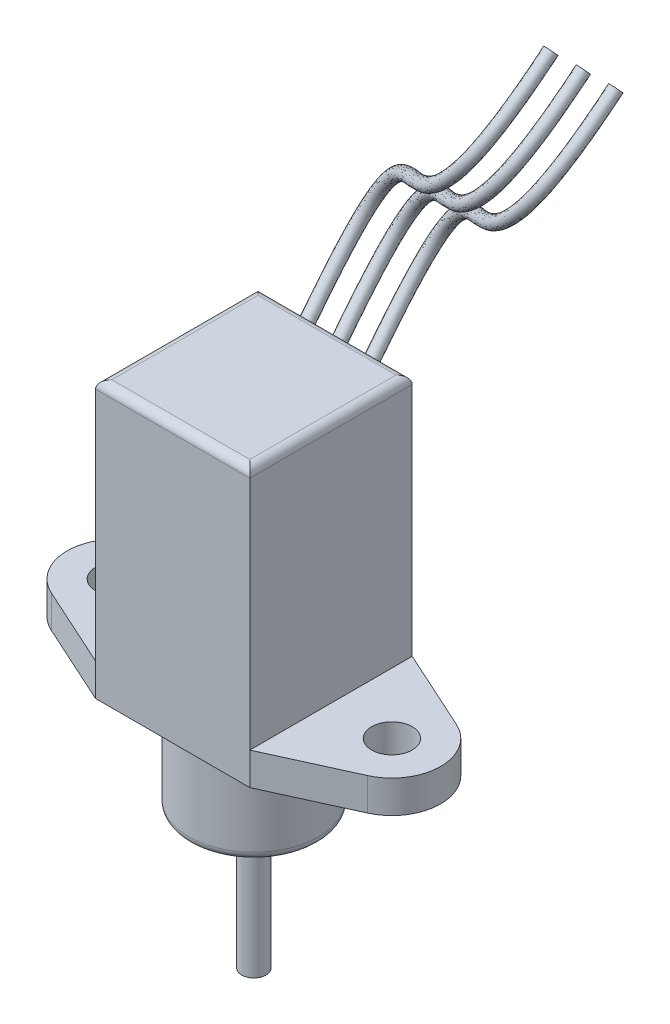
SolidWorks part; units mm, degrees
ref_plane "Plan de face" through (0, 0, 0) normal (0, 0, 1) x (1, 0, 0)
ref_plane "Plan de dessus" through (0, 0, 0) normal (0, 1, 0) x (1, 0, 0)
ref_plane "Plan de droite" through (0, 0, 0) normal (1, 0, 0) x (0, 0, -1)
sketch "Esquisse1" plane through (0, 0, 0) normal (0, 1, 0) x (1, 0, 0)
  line L0 (-9.5, 10) -> (-19.4829, 5.4622)
  line L1 (-9.5, 10) -> (9.5, 10)
  line L3 (-9.5, -10) -> (9.5, -10)
  line L5 (-19.4829, -5.4622) -> (-9.5, -10)
  line L6 (19.4829, 5.4622) -> (9.5, 10)
  line L9 (9.5, -10) -> (19.4829, -5.4622)
  circle A0 centre (17, 0) radius 2.5
  circle A1 centre (-17, 0) radius 2.5
  arc A2 (-19.4829, 5.4622) -> (-19.4829, -5.4622) centre (-17, 0) ccw
  arc A3 (19.4829, -5.4622) -> (19.4829, 5.4622) centre (17, 0) ccw
  dimension "D5" = 5
  dimension "D8" = 9.5
  dimension "D1" = 23
  dimension "D4" = 46
  dimension "D2" = 20
  dimension "D3" = 10
  dimension "D6" = 34
  dimension "D7" = 17
  dimension "D9" = 9.5
extrude "Boss.-Extru.1" add sketch "Esquisse1" along normal blind 4
sketch "Esquisse2" plane through (0, 0, 0) normal (0, -1, 0) x (1, 0, 0)
  line L2 (-0.75, 6.4566) -> (-0.75, 4.4371)
  line L4 (0.75, 6.4566) -> (0.75, 4.4371)
  line L6 (-6.4566, 0.75) -> (-4.4371, 0.75)
  line L8 (-6.4566, -0.75) -> (-4.4371, -0.75)
  line L10 (4.4371, 0.75) -> (6.4566, 0.75)
  line L11 (4.4371, -0.75) -> (6.4566, -0.75)
  line L12 (0.75, -4.4371) -> (0.75, -6.4566)
  line L13 (-0.75, -4.4371) -> (-0.75, -6.4566)
  circle A0 centre (0, 0) radius 8
  arc A1 (0.75, -4.4371) -> (4.4371, -0.75) centre (0, 0) ccw
  arc A2 (0.75, -6.4566) -> (6.4566, -0.75) centre (0, 0) ccw
  arc A3 (-4.4371, -0.75) -> (-0.75, -4.4371) centre (0, 0) ccw
  arc A4 (-6.4566, -0.75) -> (-0.75, -6.4566) centre (0, 0) ccw
  arc A5 (-0.75, 6.4566) -> (-6.4566, 0.75) centre (0, 0) ccw
  arc A6 (-0.75, 4.4371) -> (-4.4371, 0.75) centre (0, 0) ccw
  arc A7 (6.4566, 0.75) -> (0.75, 6.4566) centre (0, 0) ccw
  arc A8 (4.4371, 0.75) -> (0.75, 4.4371) centre (0, 0) ccw
  dimension "D1" = 16
  dimension "D2" = 13
  dimension "D3" = 9
  dimension "D4" = 1.5
  dimension "D5" = 1.5
  dimension "D6" = 0.75
  dimension "D7" = 0.75
extrude "Boss.-Extru.2" add sketch "Esquisse2" along normal blind 12
sketch "Esquisse3" plane through (0, 4, 0) normal (0, 1, 0) x (1, 0, 0)
  line L0 (9.5, 10) -> (-9.5, 10) construction
  line L1 (-9.5, 10) -> (9.5, 10)
  line L2 (-9.5, 10) -> (-9.5, -10)
  line L3 (-9.5, -10) -> (9.5, -10)
  line L4 (9.5, 10) -> (9.5, -10)
  line L5 (-9.5, -10) -> (9.5, -10) construction
  dimension "D1" = 19
  dimension "D2" = 9.5
extrude "Boss.-Extru.3" add sketch "Esquisse3" along normal blind 30
fillet "Congé2" radius 1 5 edges at (0, -12, -8) (0, 34, -10) (9.5, 34, 0) (-9.5, 34, 0) (0, 34, 10)
sketch "Esquisse4" plane through (0, -12, 0) normal (0, -1, 0) x (1, 0, 0)
  circle A0 centre (0, 0) radius 1.5
  dimension "D1" = 3
extrude "Boss.-Extru.4" add sketch "Esquisse4" along normal blind 17
sketch3d "Esquisse3D1"
  spline S0 degree 3 poles (-5.2025, 29.154, -10) (-10.9386, 52.6652, -37.8611) (19.3436, 49.0366, 8.154) (20.6831, 71.2321, -15.8991) knots 0 0 0 0 1 1 1 1
ref_plane "Plan1" through (20.6831, 71.2321, -15.8991) normal (0.0409, 0.6776, -0.7343) x (0.8994, -0.3451, -0.2684)
sketch "Esquisse5" plane through (20.6831, 71.2321, -15.8991) normal (0.0409, 0.6776, -0.7343) x (0.8994, -0.3451, -0.2684)
  circle A0 centre (0, 0) radius 0.75
  dimension "D1" = 1.5
sweep "Balayage1" add profiles "Esquisse5" path "Esquisse3D1"
pattern_linear "Répétition linéaire1" count 3 spacing 4 along (-1, 0, 0) of "Balayage1"
